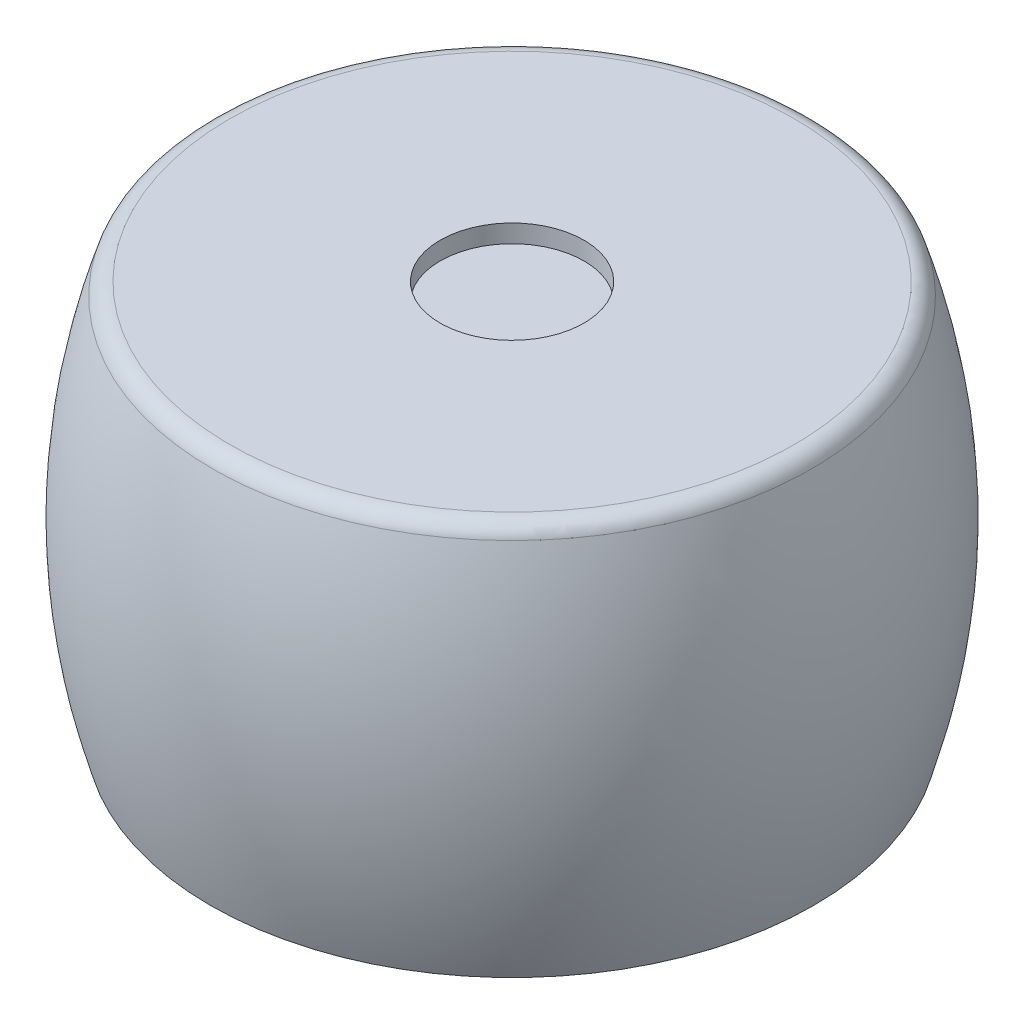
SolidWorks part; units mm, degrees
ref_plane "Alzado" through (0, 0, 0) normal (0, 0, 1) x (1, 0, 0)
ref_plane "Planta" through (0, 0, 0) normal (0, 1, 0) x (1, 0, 0)
ref_plane "Vista lateral" through (0, 0, 0) normal (1, 0, 0) x (0, 0, -1)
sketch "Croquis1" plane through (0, 0, 0) normal (0, 0, 1) x (1, 0, 0)
  line L0 (0, 32.5) -> (0, -32.5)
  line L19 (0, 32.5) -> (-49.2875, 32.5)
  line L25 (0, -32.5) -> (-50.3514, -32.5)
  spline S0 degree 2 poles (-49.2875, 32.5) (-60.1779, 0.1653) (-50.3514, -32.5) knots 0 0 0 1 1 1
  point P0 (0, 0)
  point P1 (0, 0)
  point P4 (0, 0)
  point P6 (0, -32.5)
  point P7 (-49.2875, 32.5)
  point P8 (-50.3514, -32.5)
  point P11 (0, 32.5)
revolve "Revolución1" add sketch "Croquis1" angle 360 about L0
fillet "Redondeo1" radius 3 1 edges at (-49.2875, 32.5, 0)
shell "Vaciado1" thickness 3
sketch "Croquis2" plane through (0, 32.5, 0) normal (0, 1, 0) x (1, 0, 0)
  circle A0 centre (0, 0) radius 12
extrude "Cortar-Extruir1" cut sketch "Croquis2" against normal blind 10
sketch "Croquis3" plane through (0, 29.5, 0) normal (0, -1, 0) x (1, 0, 0)
  circle A0 centre (0, 0) radius 30
extrude "Saliente-Extruir1" add sketch "Croquis3" along normal blind 12 separate body
sketch "Croquis4" plane through (0, 17.5, 0) normal (0, -1, 0) x (1, 0, 0)
  circle A0 centre (0, 0) radius 30
extrude "Saliente-Extruir2" add sketch "Croquis4" along normal blind 19 separate body
fillet "Redondeo2" radius 3 1 edges at (30, -1.5, 0)
